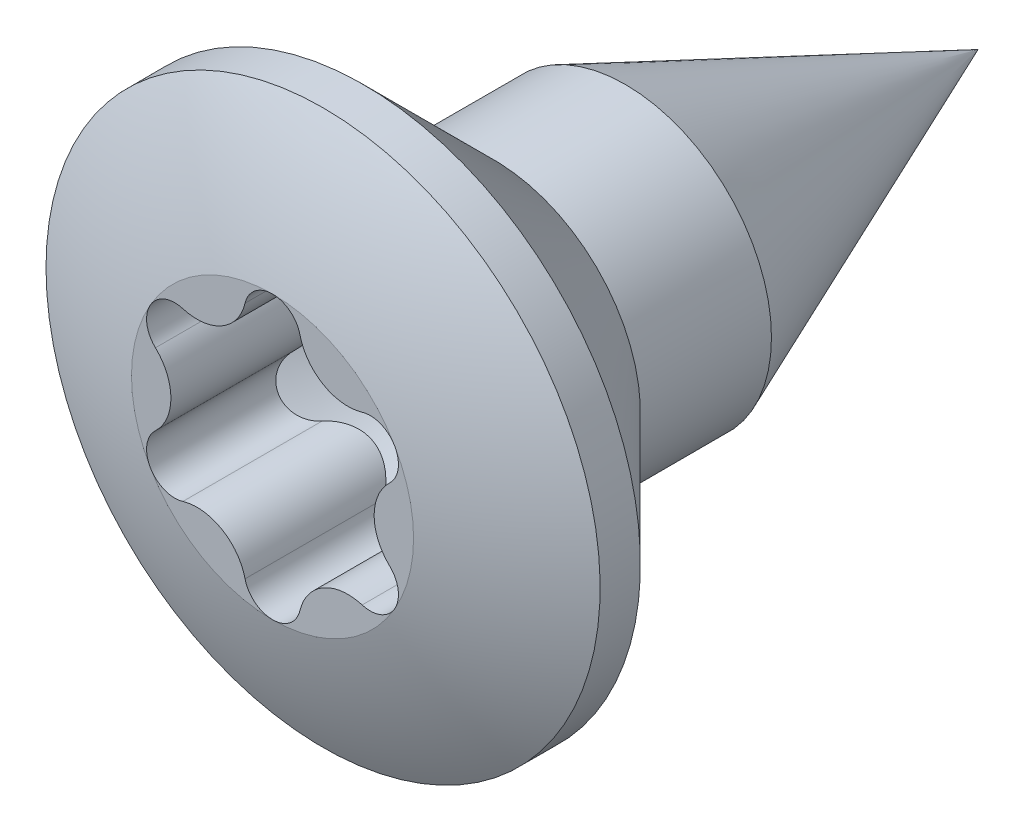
SolidWorks part; units mm, degrees
ref_plane "Front Plane" through (0, 0, 0) normal (0, 0, 1) x (1, 0, 0)
ref_plane "Top Plane" through (0, 0, 0) normal (0, 1, 0) x (1, 0, 0)
ref_plane "Right Plane" through (0, 0, 0) normal (1, 0, 0) x (0, 0, -1)
other "Configuration Table"
sketch "BodySke" plane through (0, 0, 0) normal (1, 0, 0) x (0, 0, -1)
  line L0 (0, 0) -> (-1787.2758, 0) construction
  line L1 (0, 1.4) -> (0, 0)
  line L2 (0.9017, 2.75) -> (2.2017, 1.45)
  line L3 (0.9017, -2.75) -> (2.2017, -1.45) construction
  line L4 (2.2017, 1.45) -> (3.5023, 1.45)
  line L5 (7.0017, 0.0005) -> (7.0017, 0)
  line L6 (7.0017, 0) -> (0, 0)
  line L7 (7.0017, 0.0005) -> (3.5023, 1.45)
  line L8 (0.9017, 2.75) -> (0.5017, 2.75)
  line L9 (7.0017, -0.0005) -> (3.5023, -1.45) construction
  arc A0 (0, 1.4) -> (0.5017, 2.75) centre (5.8344, 0) cw
  point P18 (0.7017, 2.75)
revolve "Base-Revolve" add sketch "BodySke" angle 360 about L0
sketch "PreBSke" plane through (0, 0, 0) normal (1, 0, 0) x (0, 0, -1)
  line L0 (0, 0) -> (-50000, 0) construction
  line L1 (0, 0) -> (0, 1.4)
  line L3 (0, 1.4) -> (1.27, 1.4)
  line L4 (1.27, 1.4) -> (2.1112, 0)
  line L5 (2.1112, 0) -> (0, 0)
  line L6 (1.27, -1.4) -> (2.1112, 0) construction
  dimension "D1" = 118
  dimension "T" = 1.27
sketch "HexSke" plane through (0, 0, 0) normal (0, 0, 1) x (1, 0, 0)
  line L0 (0, 0) -> (-42905.1683, 24771.3105) construction
  line L1 (0, 0) -> (-42905.1683, -24771.3105) construction
  line L2 (0, 0) -> (50000, 0) construction
  arc A0 (-1.1621, -0.3564) -> (-1.1621, 0.3564) centre (-1.4984, 0) ccw
  arc A1 (-1.2124, 0.7) -> (-1.1621, 0.3564) centre (-0.9699, 0.56) ccw
  arc A2 (-1.1621, -0.3564) -> (-1.2124, -0.7) centre (-0.9699, -0.56) ccw
  arc A3 (-0.8897, 0.8282) -> (-1.2124, 0.7) centre (-0.9699, 0.56) ccw
  circle A4 centre (0, 0) radius 1.0084 construction
  arc A6 (-0.8897, 0.8282) -> (-0.2724, 1.1846) centre (-0.7492, 1.2977) ccw
  arc A7 (0, 1.4) -> (-0.2724, 1.1846) centre (0, 1.12) ccw
  arc A8 (0.2724, 1.1846) -> (0, 1.4) centre (0, 1.12) ccw
  arc A9 (0.2724, 1.1846) -> (0.8897, 0.8282) centre (0.7492, 1.2977) ccw
  arc A10 (1.2124, 0.7) -> (0.8897, 0.8282) centre (0.9699, 0.56) ccw
  arc A11 (1.1621, 0.3564) -> (1.2124, 0.7) centre (0.9699, 0.56) ccw
  arc A12 (1.1621, 0.3564) -> (1.1621, -0.3564) centre (1.4984, 0) ccw
  arc A13 (1.2124, -0.7) -> (1.1621, -0.3564) centre (0.9699, -0.56) ccw
  arc A14 (0.8897, -0.8282) -> (1.2124, -0.7) centre (0.9699, -0.56) ccw
  arc A15 (0.8897, -0.8282) -> (0.2724, -1.1846) centre (0.7492, -1.2977) ccw
  arc A16 (0, -1.4) -> (0.2724, -1.1846) centre (0, -1.12) ccw
  arc A17 (-0.2724, -1.1846) -> (0, -1.4) centre (0, -1.12) ccw
  arc A18 (-0.2724, -1.1846) -> (-0.8897, -0.8282) centre (-0.7492, -1.2977) ccw
  arc A19 (-1.2124, -0.7) -> (-0.8897, -0.8282) centre (-0.9699, -0.56) ccw
  circle A20 centre (0, 0) radius 1.4 construction
  circle A21 centre (0, 0) radius 1.4
  point P56 (0, 0)
revolve "PreBroach" cut sketch "PreBSke" angle 360 about L0
extrude "Hexalobular" add sketch "HexSke" against normal up to surface (1.3808 mm away) contours A7 A3 A6 M35 | A10 A8 A9 M35 | A13 A11 A12 M35 | A16 A14 A15 M35 | A19 A17 A18 M35 | A2 A0 A1 M35
fillet "TypeRFillet" [suppressed] radius 0.25
sketch "ThdSchSke" plane through (0, 0, 0) normal (1, 0, 0) x (0, 0, -1)
  line L3 (3.5023, 1.45) -> (2.9866, 1.45)
  line L4 (0, 0) -> (-50000, 0) construction
  line L8 (3.5023, 1.45) -> (2.2017, 1.45) construction
  line L9 (2.9866, 1.45) -> (3.1944, 1.09)
  line L10 (3.1944, 1.09) -> (3.2944, 1.09)
  line L11 (3.2944, 1.09) -> (3.5023, 1.45)
  line L13 (3.2444, 1.45) -> (3.2444, 1.09) construction
revolve "ThreadSchematic" [suppressed] cut sketch "ThdSchSke" angle 360 about L4
pattern_linear "ThdSchPat" [suppressed] count 3
equation "\"Ri@HexSke\"=.1 * \"A@BodySke\""
equation "\"Re@HexSke\"=.175 * \"A@BodySke\""
equation "\"D5@ThdSchPat\" = \"F@BodySke\" + \"K@BodySke\" + \"Pitch@ThdSchPat\""
equation "\"MinorDia@ThreadCosmetic\"=\"MinorDia@ThdSchSke\""
equation "\"ThreadLength\"= \"L@BodySke\" - \"F@BodySke\" - \"K@BodySke\""
equation "\"ThdLen@ThreadCosmetic\"=\"ThreadLength\""
